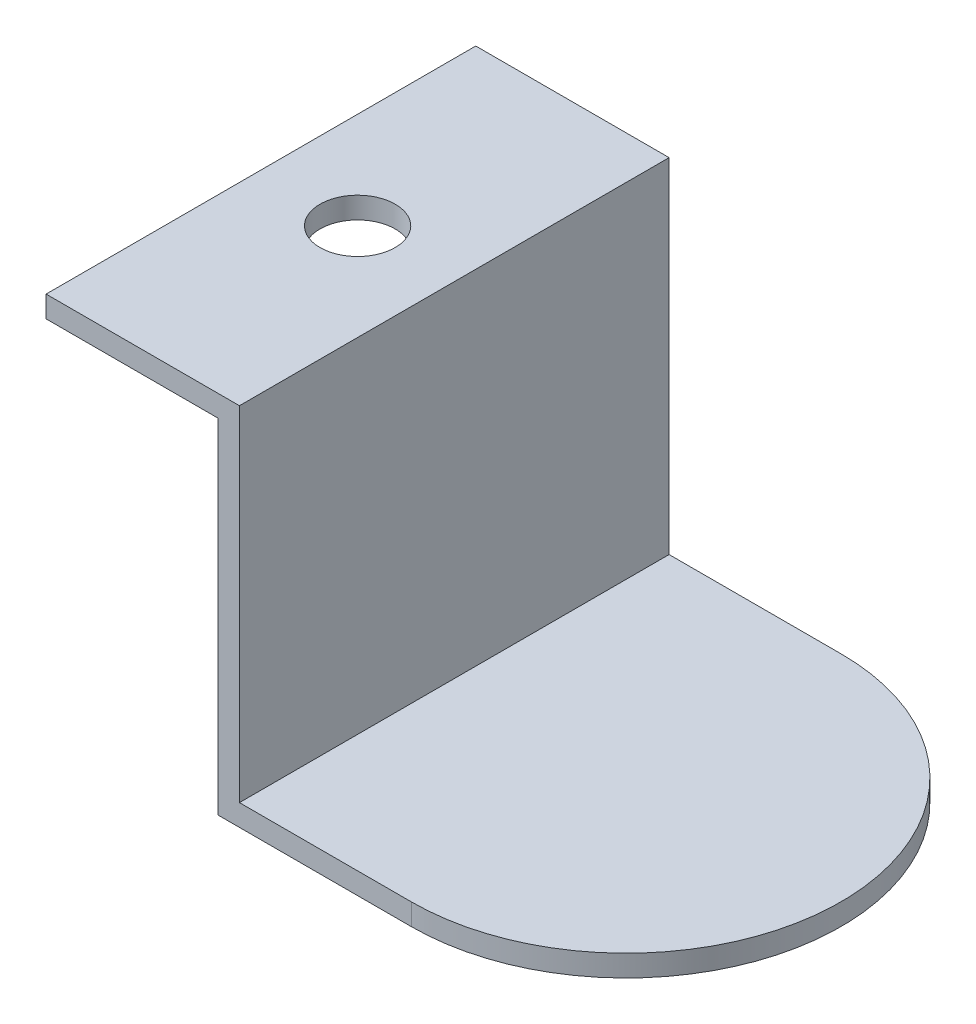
SolidWorks part; units mm, degrees
ref_plane "Front" through (0, 0, 0) normal (0, 0, 1) x (1, 0, 0)
ref_plane "Top" through (0, 0, 0) normal (0, 1, 0) x (1, 0, 0)
ref_plane "Right" through (0, 0, 0) normal (1, 0, 0) x (0, 0, -1)
sketch "Sketch1" plane through (0, 0, 0) normal (0, 0, 1) x (1, 0, 0)
  line L0 (0, 0) -> (9, 0)
  line L1 (9, 0) -> (9, -16)
  line L2 (9, -16) -> (27, -16)
  line L3 (0, -1) -> (8, -1)
  line L4 (8, -1) -> (8, -17)
  line L5 (8, -17) -> (27, -17)
  line L6 (27, -16) -> (27, -17)
  line L7 (0, 0) -> (0, -1)
  line L8 (9, -17) -> (27, -17) construction
  line L9 (8, 0) -> (8, -16) construction
  line L10 (0, -1) -> (9, -1) construction
extrude "Extrude1" add sketch "Sketch1" along normal blind 20
sketch "Sketch2" plane through (0, 0, 0) normal (0, 1, 0) x (-1, 0, 0)
  circle A0 centre (-4.5, 10) radius 1.75
extrude "Cut-Extrude1" cut sketch "Sketch2" against normal blind 20
sketch "Sketch3" plane through (0, -16, 0) normal (0, 1, 0) x (-1, 0, 0)
  line L2 (-17, 0) -> (-31.7922, 0)
  line L3 (-31.7922, 0) -> (-31.7922, 20)
  line L4 (-31.7922, 20) -> (-17, 20)
  arc A0 (-17, 20) -> (-17, 0) centre (-17, 10) ccw
extrude "Cut-Extrude2" cut sketch "Sketch3" against normal blind 20
